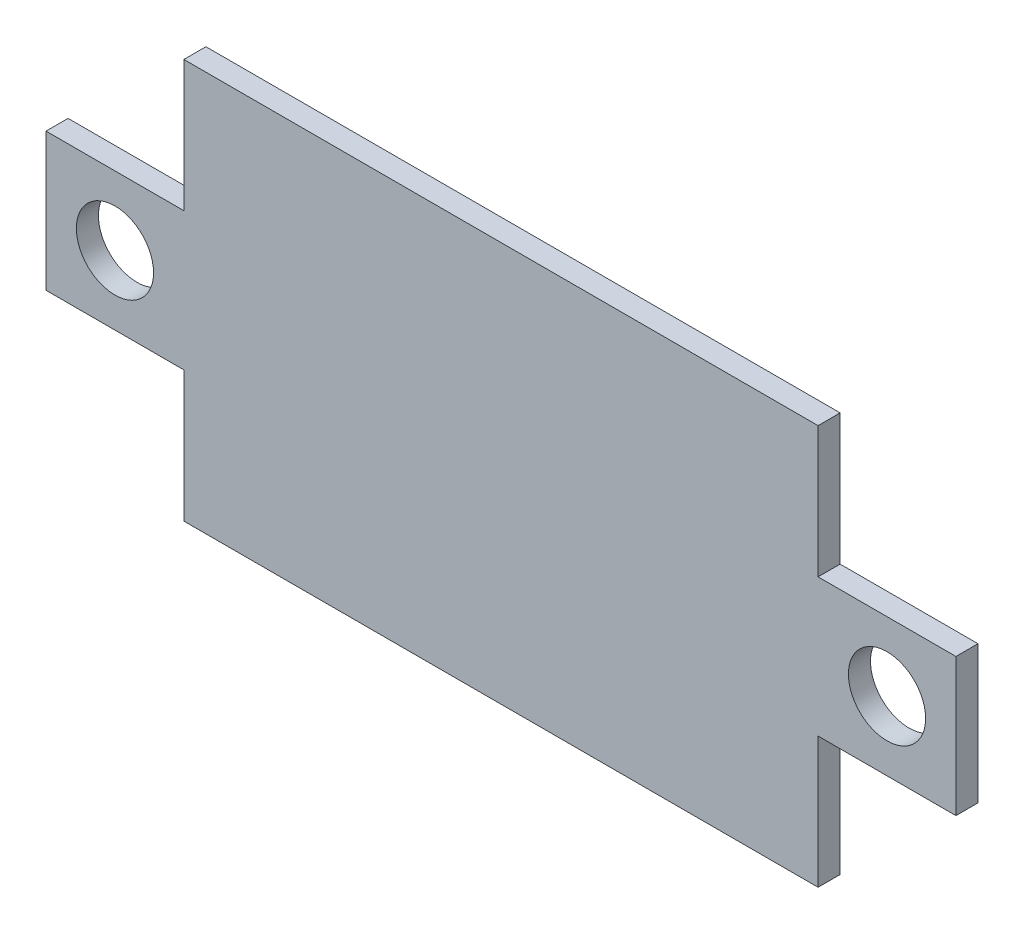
SolidWorks part; units mm, degrees
ref_plane "Front Plane" through (0, 0, 0) normal (0, 0, 1) x (1, 0, 0)
ref_plane "Top Plane" through (0, 0, 0) normal (0, 1, 0) x (1, 0, 0)
ref_plane "Right Plane" through (0, 0, 0) normal (1, 0, 0) x (0, 0, -1)
sketch "Sketch1" plane through (0, 0, 0) normal (0, 0, 1) x (1, 0, 0)
  line L1 (0, 0) -> (-23, 0)
  line L2 (0, 0) -> (0, -14.5)
  line L3 (0, -14.5) -> (-23, -14.5)
  line L4 (-23, 0) -> (-23, -14.5)
  line L5 (-23, -4.75) -> (-28, -4.75)
  line L6 (-23, -4.75) -> (-23, -9.75)
  line L7 (-23, -9.75) -> (-28, -9.75)
  line L8 (-28, -4.75) -> (-28, -9.75)
  line L9 (0, -4.75) -> (5, -4.75)
  line L10 (0, -4.75) -> (0, -9.75)
  line L11 (0, -9.75) -> (5, -9.75)
  line L12 (5, -4.75) -> (5, -9.75)
  circle A0 centre (-25.5, -7.25) radius 1.4
  circle A1 centre (2.5, -7.25) radius 1.4
  point P13 (-28, -7.25)
  point P14 (-23, -7.25)
  point P15 (5, -7.25)
  point P20 (-25.5, -4.75)
  point P21 (0, 0)
  point P22 (2.5, -4.75)
  dimension "D4" = 2.8
  dimension "D1" = 23
  dimension "D2" = 14.5
  dimension "D3" = 5
extrude "Boss-Extrude1" add sketch "Sketch1" along normal mid plane 0.8 contours L1 L4 L3 L2 | L5 L8 L7 L4 A0 | L12 L9 L2 L11 A1
